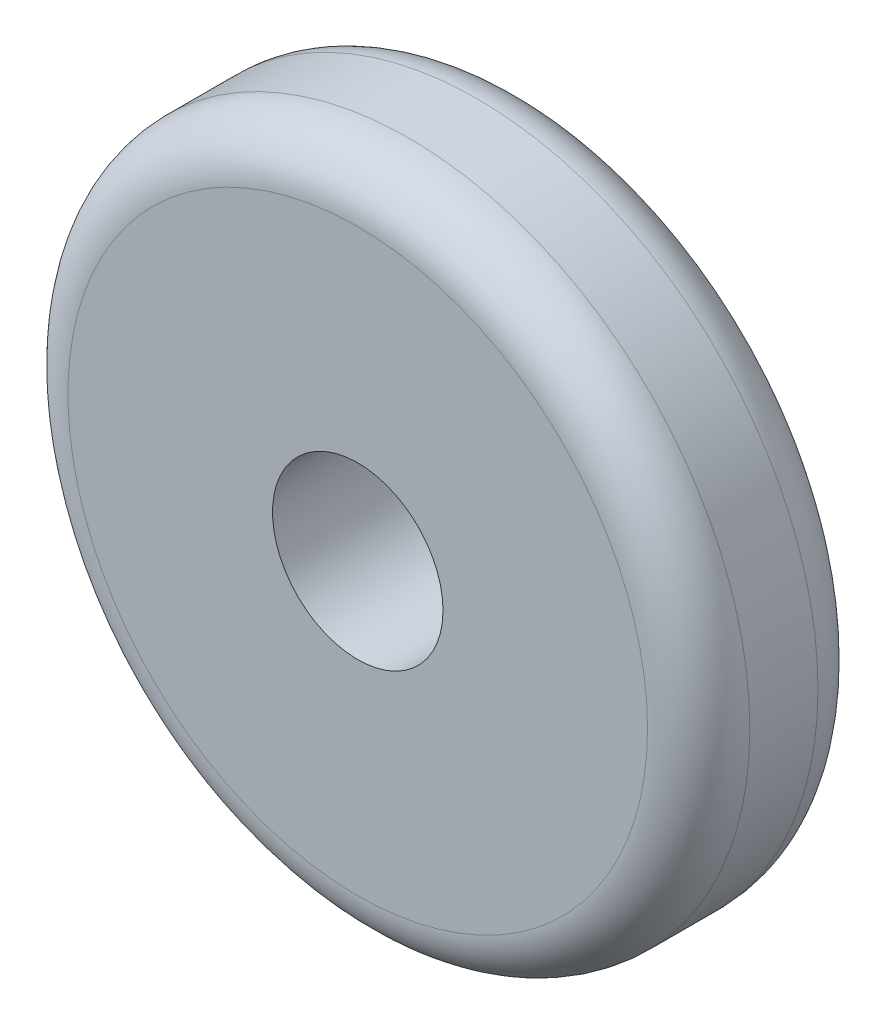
SolidWorks part; units mm, degrees
ref_plane "Front" through (0, 0, 0) normal (0, 0, 1) x (1, 0, 0)
ref_plane "Top" through (0, 0, 0) normal (0, 1, 0) x (1, 0, 0)
ref_plane "Right" through (0, 0, 0) normal (1, 0, 0) x (0, 0, -1)
sketch "Эскиз1" plane through (0, 0, 0) normal (0, 0, 1) x (1, 0, 0)
  circle A0 centre (-21.1503, 29.963) radius 20
  circle A1 centre (-21.1503, 29.963) radius 5
extrude "Вытянуть1" add sketch "Эскиз1" along normal blind 10
fillet "Скругление1" radius 3 2 edges at (-1.1503, 29.963, 0) (-1.1503, 29.963, 10)
